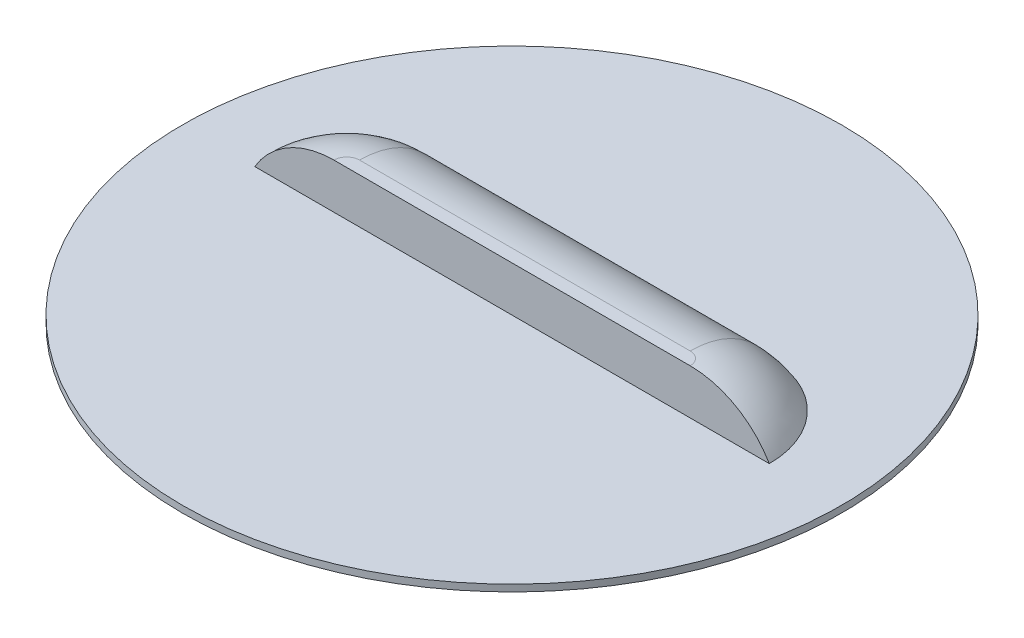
SolidWorks part; units mm, degrees
ref_plane "Front Plane" through (0, 0, 0) normal (0, 0, 1) x (1, 0, 0)
ref_plane "Top Plane" through (0, 0, 0) normal (0, 1, 0) x (1, 0, 0)
ref_plane "Right Plane" through (0, 0, 0) normal (1, 0, 0) x (0, 0, -1)
sketch "Sketch1" plane through (0, 0, 0) normal (0, 1, 0) x (1, 0, 0)
  line L1 (-50.8, 25.4) -> (50.8, 25.4) construction
  line L2 (-50.8, 25.4) -> (-50.8, -25.4) construction
  line L3 (-50.8, -25.4) -> (50.8, -25.4) construction
  line L4 (50.8, 25.4) -> (50.8, -25.4) construction
  line L5 (-50.8, 25.4) -> (50.8, -25.4) construction
  line L6 (-50.8, -25.4) -> (50.8, 25.4) construction
  circle A0 centre (0, 0) radius 44.45
  point P0 (0, 0)
  dimension "D3" = 88.9
  dimension "D1" = 50.8
  dimension "D2" = 101.6
extrude "Extrude1" add sketch "Sketch1" along normal blind 0.9144
sketch "Sketch2" plane through (0, 0.9144, 0) normal (0, 1, 0) x (1, 0, 0)
  line L0 (-34.6964, 0) -> (34.7075, 0)
  line L8 (-22.2901, 12.4063) -> (22.3012, 12.4063)
  line L12 (-50.8, 0) -> (50.8, 0) construction
  line L14 (-50.8, 12.4063) -> (50.8, 12.4063) construction
  arc A0 (22.3012, 12.4063) -> (34.7075, 0) centre (22.3012, 0) cw
  arc A1 (-22.2901, 12.4063) -> (-34.6964, 0) centre (-22.2901, 0) ccw
extrude "Extrude2" add sketch "Sketch2" along normal blind 6.096
fillet "Fillet1" radius 12.3952 3 edges at (31.0738, 7.0104, -8.7726) (0.0055, 7.0104, -12.4063) (-31.0627, 7.0104, -8.7726)
